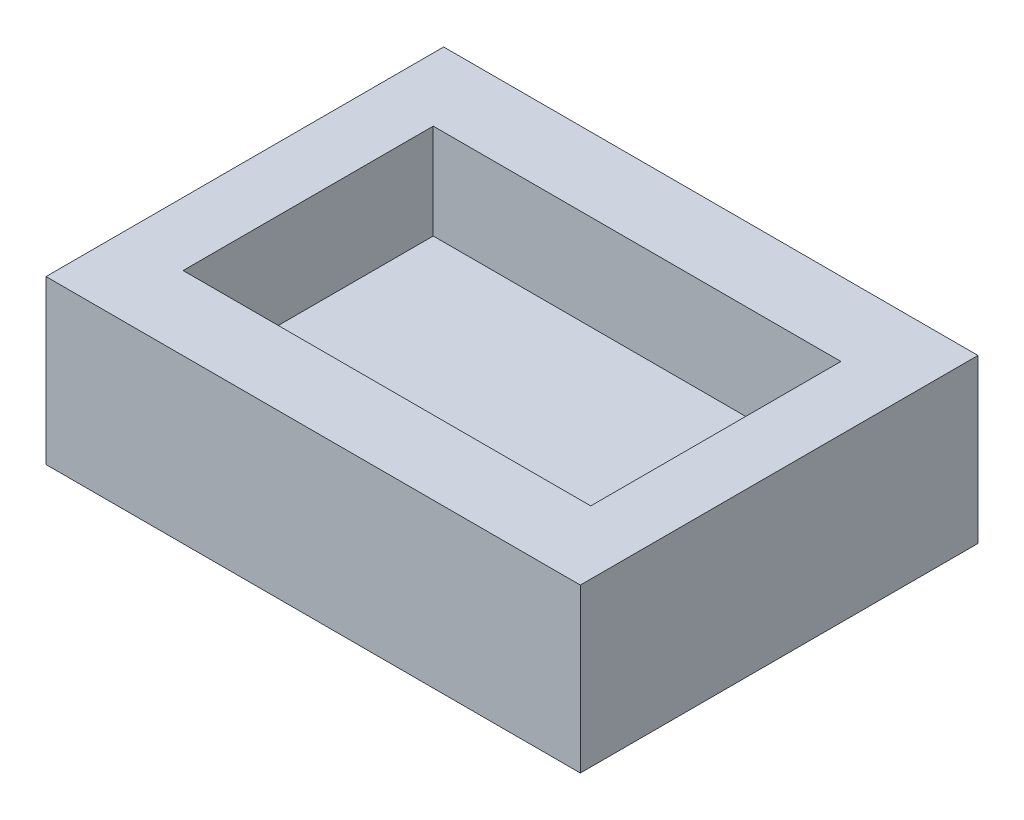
SolidWorks part; units mm, degrees
ref_plane "Front Plane" through (0, 0, 0) normal (0, 0, 1) x (1, 0, 0)
ref_plane "Top Plane" through (0, 0, 0) normal (0, 1, 0) x (1, 0, 0)
ref_plane "Right Plane" through (0, 0, 0) normal (1, 0, 0) x (0, 0, -1)
sketch "Sketch1"
extrude "Extrude1" add sketch "Sketch1" along normal blind 49.53
sketch "Sketch2"
extrude "Extrude2" cut sketch "Sketch2" against normal blind 28.956
